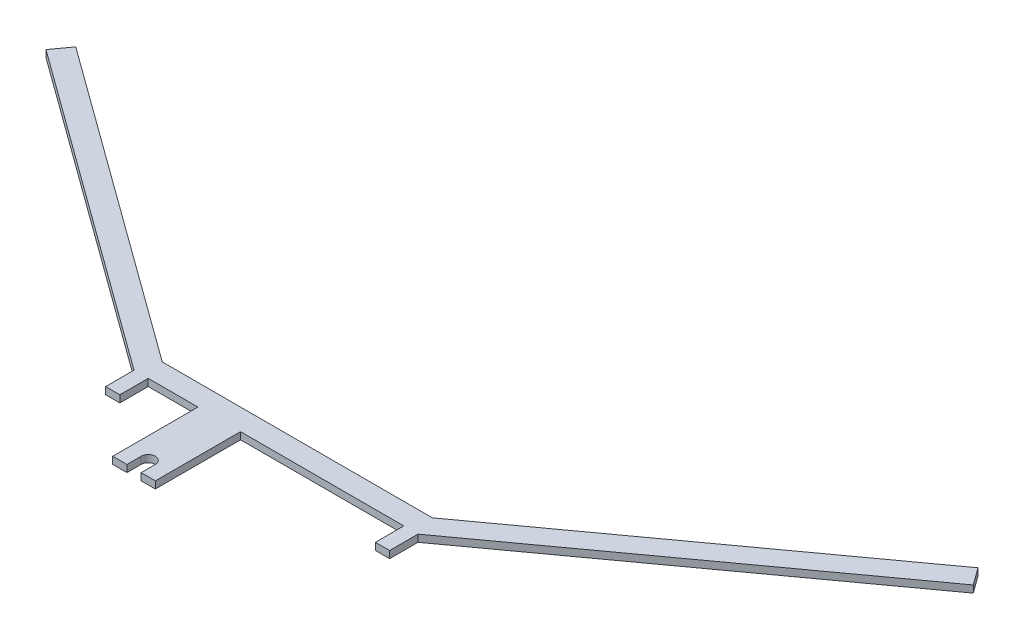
SolidWorks part; units mm, degrees
ref_plane "前视基准面" through (0, 0, 0) normal (0, 0, 1) x (1, 0, 0)
ref_plane "上视基准面" through (0, 0, 0) normal (0, 1, 0) x (1, 0, 0)
ref_plane "右视基准面" through (0, 0, 0) normal (1, 0, 0) x (0, 0, -1)
sketch "草图1" plane through (0, 0, 0) normal (0, 1, 0) x (1, 0, 0)
  line L0 (0, 0) -> (0, -51.4782) construction
  line L1 (-31.7734, -28.8317) -> (-9.5127, -45)
  line L2 (-9.5127, -45) -> (9.5127, -45)
  line L3 (-31.7734, -28.8317) -> (-32.6549, -30.0454)
  line L4 (-32.6549, -30.0454) -> (-10, -46.5)
  line L5 (-10, -46.5) -> (10, -46.5)
  line L6 (31.7734, -28.8317) -> (32.6549, -30.0454)
  line L7 (31.7734, -28.8317) -> (9.5127, -45)
  line L8 (32.6549, -30.0454) -> (10, -46.5)
  circle A0 centre (0, 0) radius 42 construction
  point P8 (0, -42)
  point P14 (0, -46.5)
  point P15 (0, -45)
  dimension "D1" = 84
  dimension "D2" = 20
  dimension "D3" = 3
  dimension "D4" = 1.5
  dimension "D5" = 1.5
  dimension "D6" = 28
extrude "凸台-拉伸1" add sketch "草图1" along normal mid plane 0.5
sketch "草图2" plane through (0, 0.25, 0) normal (0, 1, 0) x (1, 0, 0)
  line L0 (0, -45) -> (0, -49.7255) construction
  line L1 (9.5127, -45) -> (-9.5127, -45) construction
  line L2 (-10, -46.5) -> (10, -46.5) construction
  line L3 (-10, -46.5) -> (-9, -46.5)
  line L4 (-10, -46.5) -> (-10, -48.5)
  line L5 (-10, -48.5) -> (-9, -48.5)
  line L6 (-9, -46.5) -> (-9, -48.5)
  line L7 (10, -48.5) -> (9, -48.5)
  line L8 (9, -46.5) -> (9, -48.5)
  line L9 (10, -46.5) -> (9, -46.5)
  line L10 (10, -46.5) -> (10, -48.5)
  point P11 (-9.5, -48.5)
  dimension "D1" = 1
  dimension "D2" = 2
extrude "凸台-拉伸2" add sketch "草图2" against normal up to surface (0.5 mm away)
sketch "草图5" plane through (0, -0.25, 0) normal (0, -1, 0) x (1, 0, 0)
  line L1 (9, 46.5) -> (13.5371, 46.5)
  line L2 (9, 46.5) -> (9, 50.8222)
  line L3 (9, 50.8222) -> (13.5371, 50.8222)
  line L4 (13.5371, 46.5) -> (13.5371, 50.8222)
extrude "切除-拉伸1" cut sketch "草图5" against normal through all
sketch "草图6" plane through (0, -0.25, 0) normal (0, -1, 0) x (1, 0, 0)
  line L0 (-9, 46.5) -> (10, 46.5) construction
  line L1 (-2.5, 46.5) -> (-5.5, 46.5)
  line L2 (-2.5, 46.5) -> (-2.5, 52.5)
  line L3 (-2.5, 52.5) -> (-5.5, 52.5)
  line L4 (-5.5, 46.5) -> (-5.5, 52.5)
  line L5 (10, 46.5) -> (10, 49.9674) construction
  dimension "D1" = 6
  dimension "D2" = 3
  dimension "D3" = 12.5
extrude "凸台-拉伸3" add sketch "草图6" against normal up to surface (0.5 mm away)
sketch "草图7" plane through (0, -0.25, 0) normal (0, -1, 0) x (1, 0, 0)
  line L0 (-4, 52.5) -> (-4, 51.5) construction
  line L1 (-2.5, 52.5) -> (-5.5, 52.5) construction
  line L2 (-4.5, 51.5) -> (-4.5, 55.2784)
  line L3 (-4.5, 55.2784) -> (-3.5, 55.2784)
  line L4 (-3.5, 55.2784) -> (-3.5, 51.5)
  arc A0 (-4.5, 51.5) -> (-3.5, 51.5) centre (-4, 51.5) ccw
  dimension "D1" = 1
  dimension "D2" = 1
extrude "切除-拉伸2" cut sketch "草图7" against normal through all
sketch "草图8" plane through (0, -0.25, 0) normal (0, -1, 0) x (1, 0, 0)
  line L0 (10, 46.5) -> (10, 48.5)
  line L1 (10, 48.5) -> (9, 48.5)
  line L2 (9, 48.5) -> (9, 46.5)
  line L3 (-2.5, 46.5) -> (10, 46.5) construction
  line L4 (9, 46.5) -> (10, 46.5)
  dimension "D1" = 1
  dimension "D2" = 2
extrude "凸台-拉伸4" add sketch "草图8" against normal up to surface (0.5 mm away)
